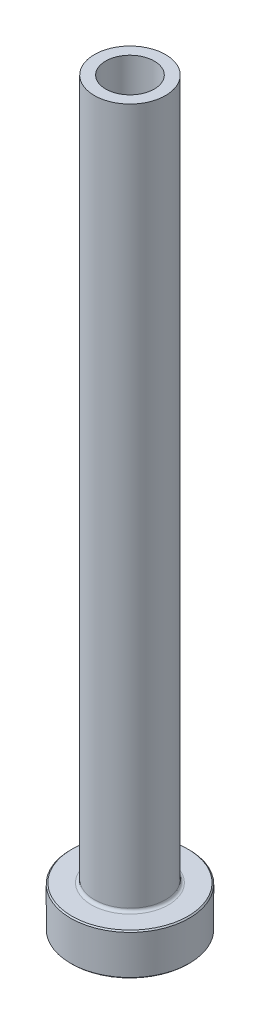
SolidWorks part; units mm, degrees
ref_plane "Front Plane" through (0, 0, 0) normal (0, 0, 1) x (1, 0, 0)
ref_plane "Top Plane" through (0, 0, 0) normal (0, 1, 0) x (1, 0, 0)
ref_plane "Right Plane" through (0, 0, 0) normal (1, 0, 0) x (0, 0, -1)
sketch "Sketch1" plane through (0, 0, 0) normal (0, 0, 1) x (1, 0, 0)
  line L0 (-4.1, 125) -> (-6, 125)
  line L1 (-6, 125) -> (-6, 7)
  line L2 (-6, 7) -> (-10, 7)
  line L3 (-10, 7) -> (-10, 0)
  line L4 (11, 0) -> (-11, 0) construction
  line L5 (-10, 0) -> (-4.35, 0)
  line L6 (-4.1, 80) -> (-4.1, 125)
  line L7 (0, 92.1877) -> (0, -15.5353) construction
  line L8 (0, -11) -> (0, 11) construction
  line L9 (-4.1, 80) -> (-4.35, 68)
  line L10 (-4.35, 68) -> (-4.35, 0)
  dimension "D1" = 0.25
  dimension "ID" = 8.2
  dimension "OD" = 12
  dimension "L" = 125
  dimension "H" = 20
  dimension "T" = 7
  dimension "N" = 45
  dimension "D2" = 12
revolve "Revolve1" add sketch "Sketch1" angle 360 about L7
fillet "Fillet1" radius 0.5 1 edges at (0, 7, 6)
chamfer "Chamfer1" distance 0.2 angle 45 2 edges at (0, 7, 10) (0, 0, 10)
chamfer "Chamfer3" distance 0.5 angle 45 1 edges at (0, 0, 4.35)
